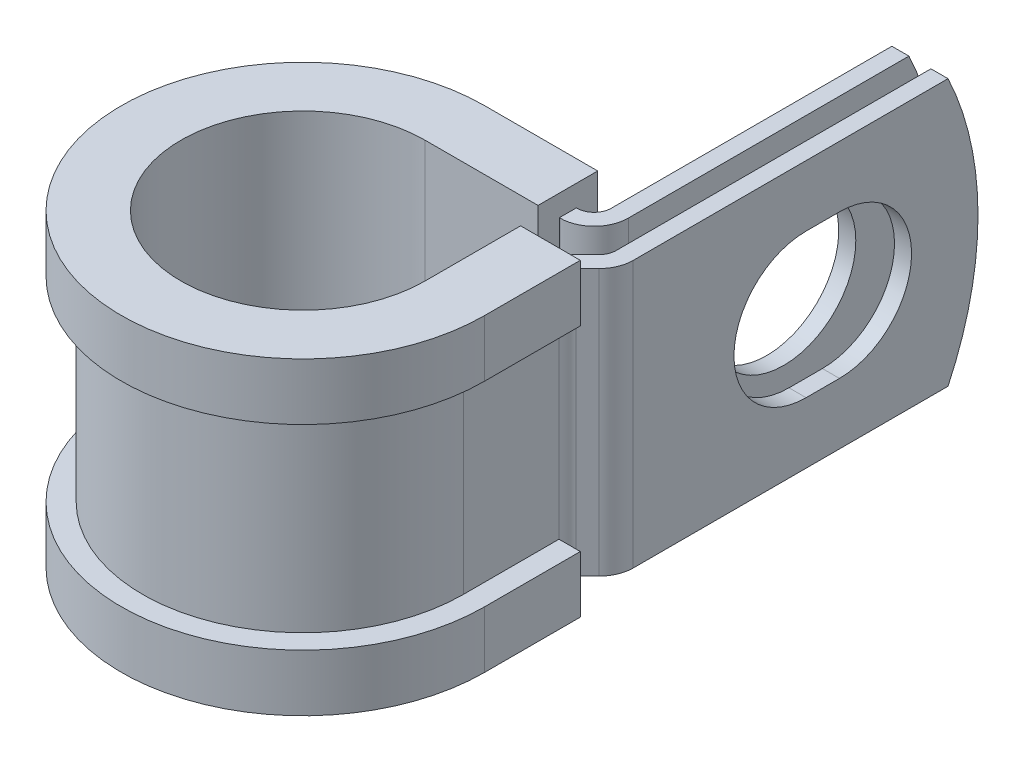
SolidWorks part; units mm, degrees
ref_plane "Front Plane" through (0, 0, 0) normal (0, 0, 1) x (1, 0, 0)
ref_plane "Top Plane" through (0, 0, 0) normal (0, 1, 0) x (1, 0, 0)
ref_plane "Right Plane" through (0, 0, 0) normal (1, 0, 0) x (0, 0, -1)
sketch "Sketch1" plane through (0, 0, 0) normal (0, 1, 0) x (1, 0, 0)
  line L0 (0, 10.2489) -> (8.1332, 10.2489)
  line L1 (10.2489, 0) -> (10.2489, 6.8364)
  line L2 (10.5716, 34.8996) -> (10.5716, 12.6873)
  line L3 (10.9631, 8.5606) -> (11.7893, 9.3868)
  line L5 (12.1464, 10.2489) -> (12.1464, 34.8996)
  arc A0 (0, 10.2489) -> (10.2489, 0) centre (0, 0) ccw
  arc A1 (10.9631, 8.5606) -> (10.2489, 6.8364) centre (12.6873, 6.8364) ccw
  arc A2 (11.7893, 9.3868) -> (12.1464, 10.2489) centre (10.9272, 10.2489) ccw
  arc A3 (8.1332, 10.2489) -> (10.5716, 12.6873) centre (8.1332, 12.6873) ccw
extrude "Extrude-Thin1" add sketch "Sketch1" along normal mid plane 19.05 thin
sketch "Sketch2" plane through (9.3524, 0, 0) normal (-1, 0, 0) x (0, 0, 1)
  line L0 (-34.8996, 9.525) -> (-34.8996, -9.525) construction
  line L1 (0, 9.525) -> (0, -9.525) construction
  circle A0 centre (-23.7998, 0) radius 5.1562
  point P2 (-34.8996, 0)
extrude "Cut-Extrude1" cut sketch "Sketch2" against normal up to surface (1.2192 mm away)
sketch "Sketch3" plane through (13.3656, 0, 0) normal (1, 0, 0) x (0, 0, -1)
  line L0 (22.606, 0) -> (24.9936, 0) construction
  line L1 (22.606, 5.1562) -> (24.9936, 5.1562)
  line L2 (22.606, -5.1562) -> (24.9936, -5.1562)
  line L3 (34.8996, 9.525) -> (34.8996, -9.525) construction
  arc A0 (22.606, 5.1562) -> (22.606, -5.1562) centre (22.606, 0) ccw
  arc A1 (24.9936, -5.1562) -> (24.9936, 5.1562) centre (24.9936, 0) ccw
  point P3 (23.7998, 0)
  point P8 (34.8996, 0)
  point P11 (17.4498, 0)
  point P12 (30.1498, 0)
extrude "Cut-Extrude2" cut sketch "Sketch3" against normal up to surface (1.2192 mm away)
sketch "Sketch4" plane through (9.3524, 0, 0) normal (-1, 0, 0) x (0, 0, 1)
  line L0 (-34.8996, 9.525) -> (-34.8996, -9.525)
  line L1 (-34.8996, 9.525) -> (-32.7551, 9.525)
  line L2 (-34.8996, 9.525) -> (-12.6873, 9.525) construction
  line L3 (-34.8996, -9.525) -> (-32.7551, -9.525)
  line L4 (-34.8996, -9.525) -> (-12.6873, -9.525) construction
  arc A0 (-32.7551, 9.525) -> (-32.7551, -9.525) centre (-12.6746, 0) ccw
extrude "Cut-Extrude3" cut sketch "Sketch4" against normal through all contours A0 M4 M5 | A0 L0 M2
ref_plane "Plane1" through (0, 0, -6.8364) normal (0, 0, -1) x (-1, 0, 0)
ref_plane "Plane2" through (8.0824, 0, 0) normal (-1, 0, 0) x (0, 0, 1)
sketch "Sketch5" plane through (0, 0, -6.8364) normal (0, 0, -1) x (-1, 0, 0)
  line L0 (-11.4681, 9.525) -> (-10.2489, 9.525)
  line L1 (-11.4681, 9.525) -> (-11.4681, -9.525) construction
  line L3 (-10.2489, 9.525) -> (-10.2489, -9.525)
  line L4 (-10.2489, -9.525) -> (-11.4681, -9.525)
  line L5 (-11.4681, -9.525) -> (-11.4681, -6.985)
  line L6 (-11.4681, 9.525) -> (-11.4681, 6.985)
  line L7 (-12.9921, 11.049) -> (-12.9921, 6.985)
  line L8 (-12.9921, 11.049) -> (-8.7249, 11.049)
  line L9 (-8.7249, 11.049) -> (-8.7249, -11.049)
  line L10 (-8.7249, -11.049) -> (-12.9921, -11.049)
  line L11 (-12.9921, -11.049) -> (-12.9921, -6.985)
  line L12 (-12.9921, 6.985) -> (-11.4681, 6.985)
  line L13 (-11.4681, -6.985) -> (-12.9921, -6.985)
sketch "Sketch6" plane through (0, 9.525, 0) normal (0, 1, 0) x (1, 0, 0)
  line L0 (8.7249, 0) -> (8.7249, 6.8364)
  line L1 (8.7249, 6.8364) -> (12.9921, 6.8364) construction
  line L2 (8.0824, 6.9878) -> (8.0824, -6.9878) construction
  line L5 (0, 8.7249) -> (8.0824, 8.7249)
  arc A0 (0, 8.7249) -> (8.7249, 0) centre (0, 0) ccw
sweep "Sweep1" add profiles "Sketch5" path "Sketch6"
equation "\"D4@Sketch5\" = \"D1@Extrude-Thin1\""
equation "\"D5@Sketch5\" = \"D5@Extrude-Thin1\""
equation "\"D1@Sketch3\" = \"D2@Sketch2\""
equation "\"D7@Sketch1\" = \"D3@Sketch2\" + \"D1@Sketch3\""
equation "\"D1@Sketch1\" = \"D1@Sketch6\" + 2 * \"D3@Sketch5\""
equation "\"D1@Sketch4\" = ( \"D1@Extrude-Thin1\" + .125 ) * 2"
equation "\"D9@Sketch1\"= \"D5@Extrude-Thin1\""
equation "\"D8@Sketch1\"= 2 * \"D5@Extrude-Thin1\""
equation "\"D2@Sketch1\" = 2 * \"D5@Extrude-Thin1\""
equation "\"D2@Sketch3\" = \"D1@Sketch2\""
